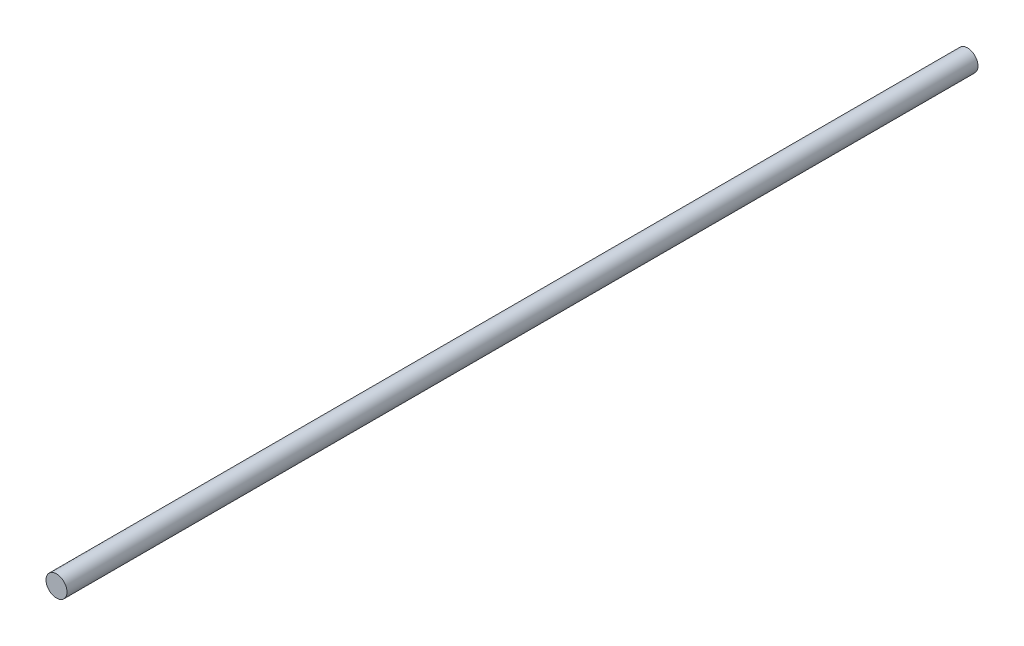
SolidWorks part; units mm, degrees
ref_plane "Front Plane" through (0, 0, 0) normal (0, 0, 1) x (1, 0, 0)
ref_plane "Top Plane" through (0, 0, 0) normal (0, 1, 0) x (1, 0, 0)
ref_plane "Right Plane" through (0, 0, 0) normal (1, 0, 0) x (0, 0, -1)
sketch "Sketch1" plane through (0, 0, 0) normal (0, 0, 1) x (1, 0, 0)
  circle A0 centre (0, 0) radius 30
  dimension "D1" = 60
extrude "Boss-Extrude1" add sketch "Sketch1" against normal blind 2600
